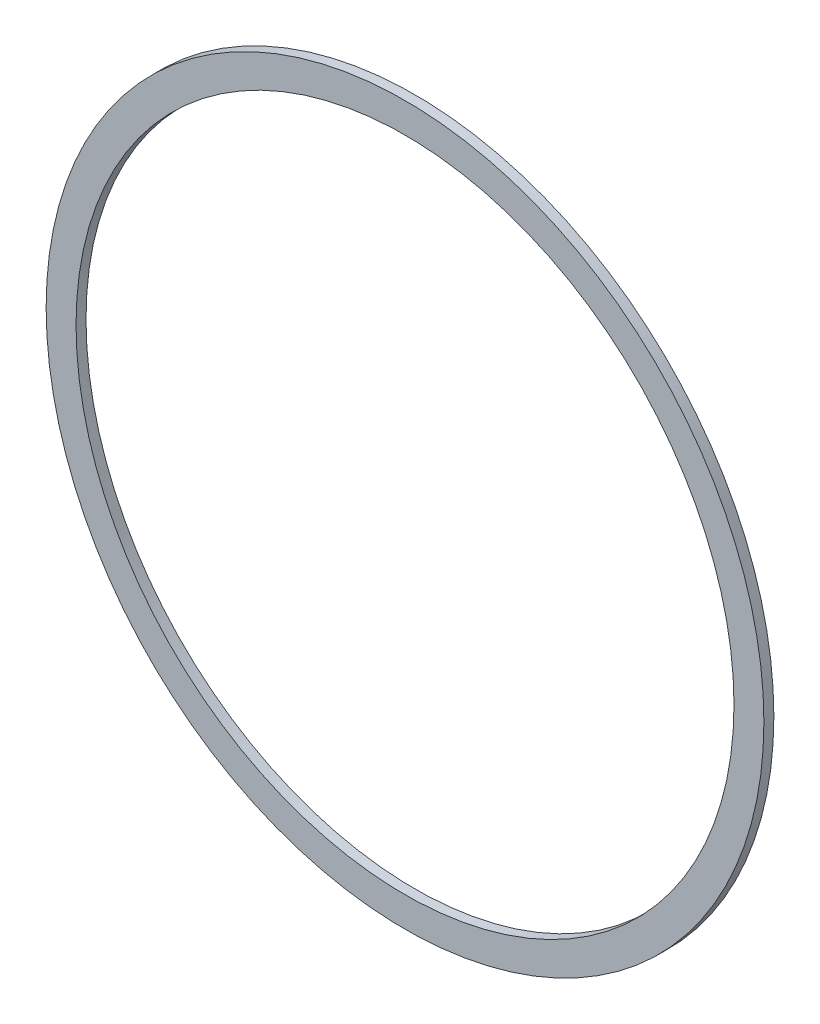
SolidWorks part; units mm, degrees
ref_plane "Спереди" through (0, 0, 0) normal (0, 0, 1) x (1, 0, 0)
ref_plane "Сверху" through (0, 0, 0) normal (0, 1, 0) x (1, 0, 0)
ref_plane "Справа" through (0, 0, 0) normal (1, 0, 0) x (0, 0, -1)
sketch "Эскиз1" plane through (0, 0, 0) normal (0, 0, 1) x (1, 0, 0)
  circle A0 centre (0, 0) radius 33
  circle A1 centre (0, 0) radius 36
  dimension "D1" = 66
  dimension "D2" = 72
extrude "Бобышка-Вытянуть1" add sketch "Эскиз1" along normal blind 1
